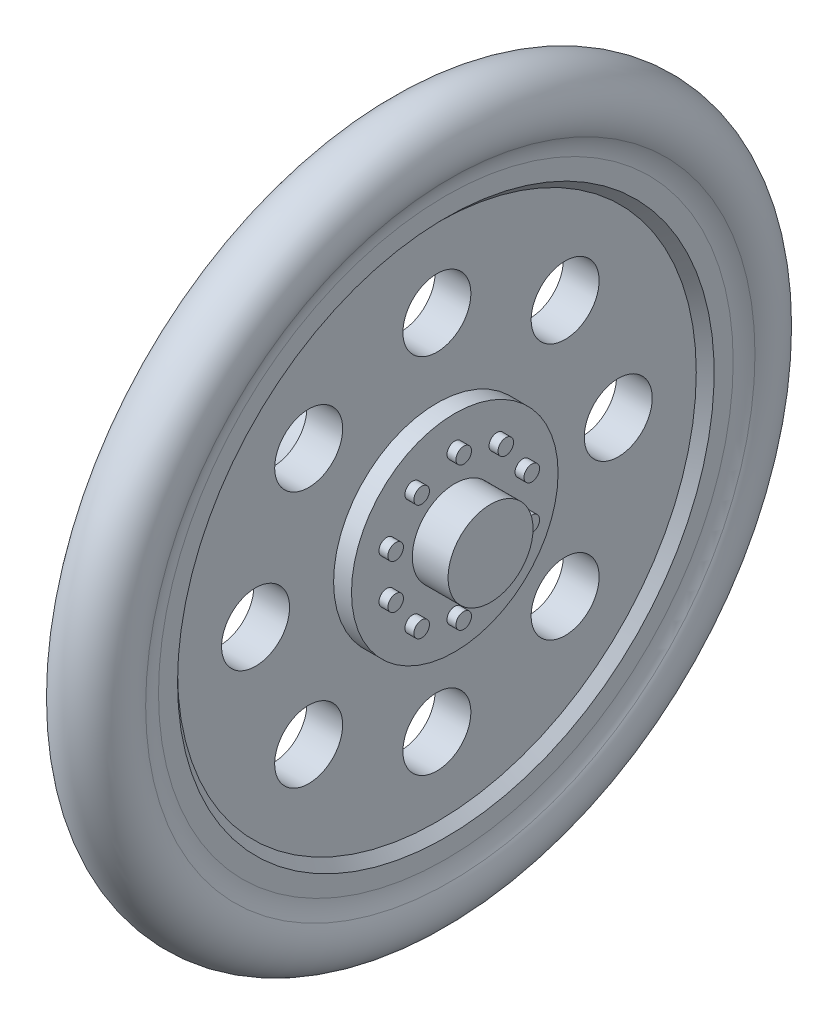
SolidWorks part; units mm, degrees
ref_plane "Front Plane" through (0, 0, 0) normal (0, 0, 1) x (1, 0, 0)
ref_plane "Top Plane" through (0, 0, 0) normal (0, 1, 0) x (1, 0, 0)
ref_plane "Right Plane" through (0, 0, 0) normal (1, 0, 0) x (0, 0, -1)
sketch "Sketch1" plane through (0, 0, 0) normal (0, 0, 1) x (1, 0, 0)
  line L0 (0, 0) -> (17.1706, 0) construction
  line L1 (9.5, 0) -> (0, 0)
  line L2 (0, 0) -> (0, 3.1)
  line L3 (0, 3.1) -> (7.5, 3.1)
  line L4 (7.5, 3.1) -> (7.5, 14.5)
  line L5 (7.5, 7.7069) -> (9.5, 7.7069) construction
  line L6 (9.5, 14.5) -> (9.5, 0)
  line L7 (8.5, 7.7069) -> (8.5, 18) construction
  line L8 (10, 15) -> (9.5, 14.5)
  line L9 (7, 16.6771) -> (7, 15)
  line L10 (7, 15) -> (7.5, 14.5)
  line L11 (10, 16.6771) -> (10, 15)
  arc A0 (10, 16.6771) -> (7, 16.6771) centre (8.5, 18) ccw
  dimension "D1" = 4
  dimension "D3" = 40
  dimension "D5" = 6.5
  dimension "D2" = 2
  dimension "D4" = 6.2
  dimension "D6" = 29
  dimension "D7" = 0.5
  dimension "D8" = 45
revolve "Revolve1" add sketch "Sketch1" angle 360 about L0
fillet "Fillet1" radius 2 2 edges at (7, 0, 16.6771) (10, 0, 16.6771)
sketch "Sketch2" plane through (9.5, 0, 0) normal (1, 0, 0) x (0, 0, -1)
  circle A0 centre (0, 0) radius 5.775
  dimension "D1" = 11.55
extrude "Extrude1" add sketch "Sketch2" along normal blind 1
sketch "Sketch3" plane through (10.5, 0, 0) normal (1, 0, 0) x (0, 0, -1)
  circle A0 centre (0, 0) radius 2.375
  dimension "D1" = 4.75
extrude "Extrude2" add sketch "Sketch3" along normal blind 2
sketch "Sketch4" plane through (10.5, 0, 0) normal (1, 0, 0) x (0, 0, -1)
  circle A0 centre (0, 0) radius 4 construction
  circle A1 centre (0, 4) radius 0.435
  dimension "D1" = 0.87
  dimension "D2" = 8
extrude "Extrude3" add sketch "Sketch4" along normal blind 0.5
pattern_circular "CirPattern1" count 10 over 360 about axis through (0, 0, 0) along (1, 0, 0) of "Extrude3"
sketch "Sketch5" plane through (9.5, 0, 0) normal (1, 0, 0) x (0, 0, -1)
  circle A0 centre (0, 0) radius 10.1375 construction
  circle A1 centre (0, 10.1375) radius 1.9
  dimension "D1" = 3.8
  dimension "D2" = 20.275
extrude "Cut-Extrude1" cut sketch "Sketch5" against normal through all
pattern_circular "CirPattern2" count 8 over 360 about axis through (0, 0, 0) along (1, 0, 0) of "Cut-Extrude1"
sketch "Sketch6" plane through (0, 0, 0) normal (-1, 0, 0) x (0, 0, 1)
  circle A0 centre (0, 0) radius 1.63
  dimension "D1" = 3.26
extrude "Cut-Extrude2" cut sketch "Sketch6" against normal offset from surface (10.9125 mm away) 1.5875
